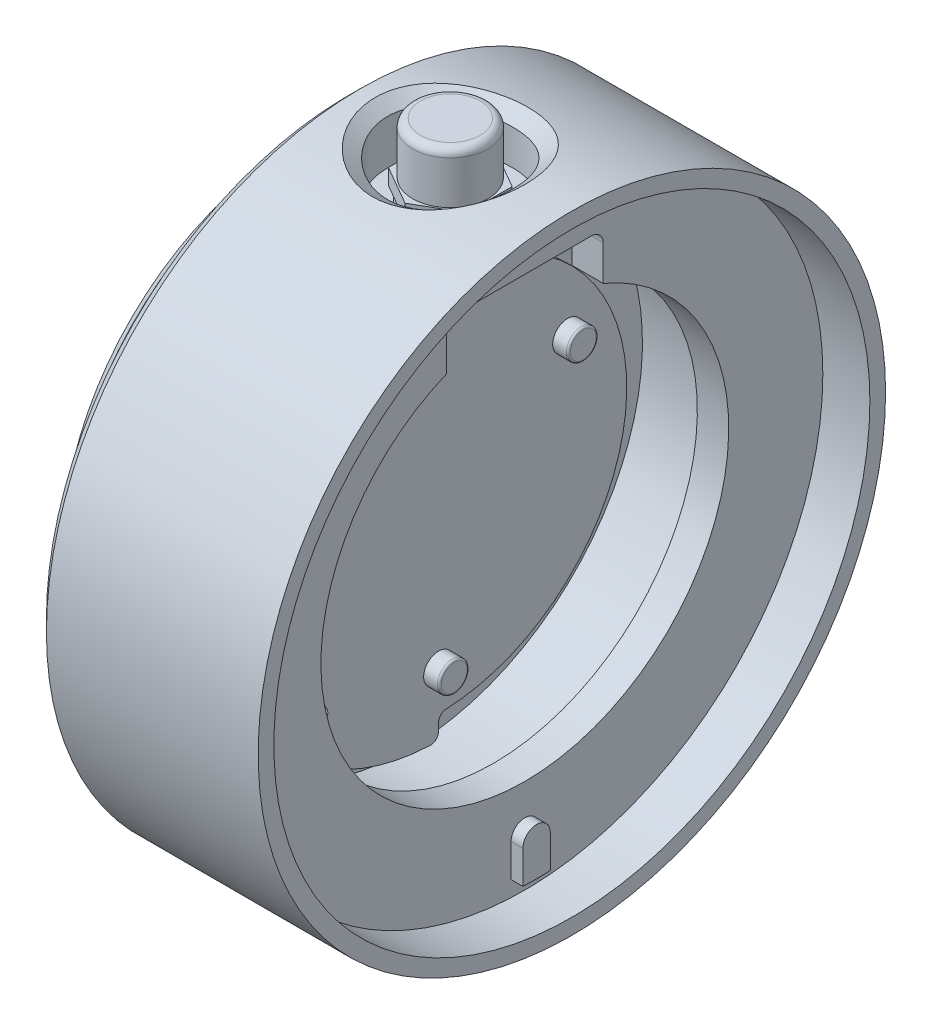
SolidWorks part; units mm, degrees
ref_plane "前视基准面" through (0, 0, 0) normal (0, 0, 1) x (1, 0, 0)
ref_plane "上视基准面" through (0, 0, 0) normal (0, 1, 0) x (1, 0, 0)
ref_plane "右视基准面" through (0, 0, 0) normal (1, 0, 0) x (0, 0, -1)
imported_body "消除特征4"
sketch "草图1" plane through (0, 0, 0) normal (-1, 0, 0) x (0, 0, 1)
  circle A2 centre (0, 0) radius 15.75 construction
  circle A3 centre (0, 0) radius 15.75
sketch "草图2" plane through (0, 0, 0) normal (-1, 0, 0) x (0, 0, 1)
  circle A0 centre (0, 25) radius 3 construction
  circle A1 centre (0, 25) radius 3
extrude "切除-拉伸2" cut sketch "草图2" against normal blind 6.5
sketch "草图3" plane through (0, 0, 0) normal (-1, 0, 0) x (0, 0, 1)
  circle A0 centre (0, 0) radius 15.75 construction
  circle A1 centre (0, 0) radius 15.75
extrude "切除-拉伸3" cut sketch "草图3" against normal blind 6.2
